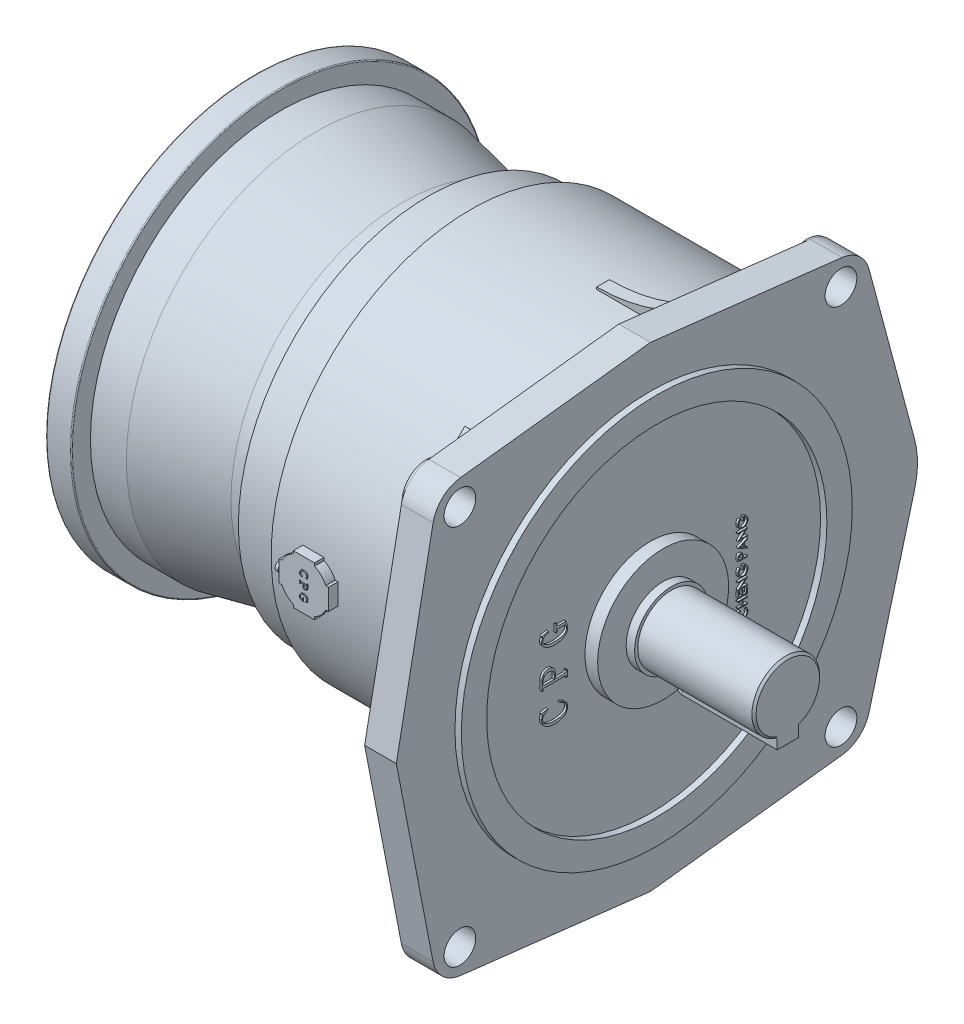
SolidWorks part; units mm, degrees
ref_plane "前视基准面" through (0, 0, 0) normal (0, 0, 1) x (1, 0, 0)
ref_plane "上视基准面" through (0, 0, 0) normal (0, 1, 0) x (1, 0, 0)
ref_plane "右视基准面" through (0, 0, 0) normal (1, 0, 0) x (0, 0, -1)
sketch "草图1" plane through (0, 0, 0) normal (0, 1, 0) x (1, 0, 0)
  line L0 (0, 0) -> (15.7361, 0) construction
  line L1 (0, 0) -> (0, -16)
  line L2 (0, -16) -> (-55, -16)
  line L3 (-55, -16) -> (-55, -17.5)
  line L4 (-55, -17.5) -> (-59, -17.5)
  line L5 (-62, -31) -> (-62, -92.5)
  line L6 (-62, -92.5) -> (-65, -92.5)
  line L7 (-65, -92.5) -> (-65, 0)
  line L8 (-65, 0) -> (0, 0)
  line L9 (-62, -31) -> (-59, -31)
  line L10 (-59, -31) -> (-59, -17.5)
  dimension "D1" = 55
  dimension "D2" = 32
  dimension "D3" = 35
  dimension "D4" = 3
  dimension "D5" = 185
  dimension "D6" = 65
  dimension "D7" = 3
  dimension "D8" = 62
revolve "旋转1" add sketch "草图1" angle 360 about L0
sketch "草图2" plane through (0, 0, 0) normal (0, 1, 0) x (1, 0, 0)
  line L0 (8.0167, 30) -> (-80, 30) construction
  line L1 (-65, 92.5) -> (-65, -92.5) construction
  line L4 (-80, 30) -> (-80, -64.5)
  line L5 (-80, -64.5) -> (-180, -64.5)
  line L6 (-180, -64.5) -> (-180, 30)
  line L11 (-80, 30) -> (-180, 30)
  dimension "D1" = 30
  dimension "D2" = 15
  dimension "D3" = 189
  dimension "D5" = 100
revolve "旋转2" add sketch "草图2" angle 360 about L0
sketch "草图12" plane through (-80, 0, 0) normal (1, 0, 0) x (0, 0, -1)
  line L0 (0, -112.5) -> (100.7627, -100.7627)
  line L1 (-100.7627, -100.7627) -> (0, -112.5)
  line L2 (-100.7627, -100.7627) -> (-120.238, 0)
  line L3 (-100.7627, 100.7627) -> (0, 112.5)
  line L4 (100.7627, -100.7627) -> (127.762, 0)
  line L5 (-120.238, 0) -> (-100.7627, 100.7627)
  line L6 (0, 112.5) -> (100.7627, 100.7627)
  line L7 (127.762, 0) -> (100.7627, 100.7627)
  line L8 (167.8979, 0) -> (-107.2143, 0) construction
  line L9 (0, 107.5085) -> (0, -103.3164) construction
  line L10 (0, 0) -> (-90.1561, 90.1561) construction
  line L11 (0, 0) -> (90.1561, 90.1561) construction
  circle A0 centre (0, 0) radius 127.5 construction
  circle A1 centre (-90.1561, 90.1561) radius 7.5
  circle A2 centre (90.1561, 90.1561) radius 7.5
  circle A3 centre (90.1561, -90.1561) radius 7.5
  circle A4 centre (-90.1561, -90.1561) radius 7.5
  dimension "D3" = 255
  dimension "D4" = 15
  dimension "D5" = 15
  dimension "D1" = 225
  dimension "D2" = 248
  dimension "D6" = 15
extrude "拉伸8" add sketch "草图12" along normal up to surface (15 mm away)
sketch "草图5" plane through (0, 0, 0) normal (0, 1, 0) x (1, 0, 0)
  line L0 (0, -5) -> (-45, -5)
  line L1 (0, -16) -> (0, 16) construction
  line L2 (-45, 5) -> (0, 5)
  line L3 (0, 5) -> (0, -5)
  line L4 (35.5, -13.7955) -> (35.5, 19.6443) construction
  arc A0 (-45, -5) -> (-45, 5) centre (-45, 0) cw
  dimension "D2" = 50
  dimension "D1" = 10
  dimension "D3" = 35.5
extrude "拉伸4" add sketch "草图5" against normal blind 19.5
fillet "圆角4" radius 15 4 edges at (-72.5, 100.7627, 100.7627) (-72.5, 100.7627, -100.7627) (-72.5, -100.7627, -100.7627) (-72.5, -100.7627, 100.7627)
fillet "圆角5" radius 40 1 edges at (-72.5, 0, -127.762)
chamfer "倒角1" distance 1 angle 45 1 edges at (0, 16, 0)
sketch "草图18" plane through (-80, 0, 0) normal (-1, 0, 0) x (0, 0, 1)
  line L0 (-30, 0) -> (73.8927, -103.8927) construction
  line L1 (0, -99) -> (0, 99) construction
  line L2 (89.8548, -102.0333) -> (0, -112.5) construction
  line L3 (36.8216, -66.8216) -> (73.8927, -103.8927)
  line L4 (-30, 0) -> (-90.1561, -90.1561) construction
  line L5 (-88.91, -87.0419) -> (-82.4506, -78.6078)
  line L7 (-30, 0) -> (-30, -109.0055) construction
  line L8 (0, -112.5) -> (-90.6456, -101.9412) construction
  line L9 (-30, -98.3819) -> (-30, -109.0055)
  circle A0 centre (-30, 0) radius 94.5 construction
  arc A1 (-103.3989, -90.9242) -> (-90.6456, -101.9412) centre (-88.91, -87.0419) ccw construction
  dimension "D1" = 45
  dimension "D2" = 10.6235
  dimension "D4" = 52.4264
  dimension "D5" = 10.6235
ref_plane "基准面7" through (-81, 0, 0) normal (1, 0, 0) x (0, 0, -1)
sketch "草图13" plane through (-80, 0, 0) normal (1, 0, 0) x (0, 0, -1)
  line L5 (0, 0) -> (107.7406, 0) construction
  circle A1 centre (90.1561, 90.1561) radius 11.6458
  circle A3 centre (90.1561, 90.1561) radius 7.5
  circle A4 centre (90.1561, -90.1561) radius 7.5 construction
  circle A5 centre (90.1561, -90.1561) radius 7.5
  circle A7 centre (-90.1561, -90.1561) radius 7.5
  arc A10 (90.6456, -101.9412) -> (103.3989, -90.9242) centre (88.91, -87.0419) ccw construction
  circle A11 centre (-90.1561, -90.1561) radius 7.5 construction
  arc A12 (-102.8467, -89.9806) -> (-89.8548, -102.0333) centre (-88.1192, -87.1341) ccw construction
  circle A14 centre (-90.1561, 90.1561) radius 7.5
  circle A15 centre (-90.1561, 90.1561) radius 11.3556
  circle A20 centre (-90.1561, -90.1561) radius 11.3556
  circle A21 centre (90.1561, -90.1561) radius 11.6458
  point P8 (30, 0)
extrude "拉伸9" add sketch "草图13" against normal up to surface (1 mm away)
sketch "草图14" plane through (0, 0, 0) normal (0, 1, 0) x (1, 0, 0)
  line L0 (-80, 30) -> (-180, 30) construction
  line L5 (-80, -89.8548) -> (-80, 0) construction
  line L6 (-117.4264, -64.5) -> (-117.4264, -65.5)
  line L7 (-80, -101.9264) -> (-81, -101.9264)
  line L9 (-80, -64.5) -> (-180, -64.5) construction
  arc A0 (-81, -101.9264) -> (-117.4264, -65.5) centre (-117.4264, -101.9264) ccw
  dimension "D1" = 131.9264
  dimension "D2" = 1
  dimension "D3" = 1
rib "筋17" sketch "草图14" sketch "草图14" thickness 6 extrusion direction parallel to sketch draft on no parameters "D1"=6
pattern_circular "阵列(圆周)16" count 8 over 360 about axis through (0, 0, -30) along (1, 0, 0) of "筋17"
ref_plane "基准面8" through (0, 0, -30) normal (0, 0, 1) x (1, 0, 0)
sketch "草图17" plane through (0, 0, -30) normal (0, 0, 1) x (1, 0, 0)
  line L0 (-80, -104.1235) -> (-81, -104.1235)
  line L1 (-80, -102.0333) -> (-80, -112.5) construction
  line L2 (-117.4264, -94.5) -> (-117.4264, -95.5)
  line L4 (-180, -94.5) -> (-80, -94.5) construction
  line L6 (-117.4264, -69.65) -> (-117.4264, -65.4074) construction
  arc A0 (-81, -104.1235) -> (-117.4264, -95.5) centre (-117.4264, -176.7456) ccw
  dimension "D1" = 9.6235
  dimension "D2" = 1
  dimension "D3" = 1
rib "筋24" sketch "草图17" sketch "草图17" thickness 6 extrusion direction parallel to sketch draft on no parameters "D1"=6
mirror "镜向1" about plane through (0, 0, 0) normal (0, 1, 0) of "筋24"
sketch "草圖1" plane through (0, 0, 0) normal (0, 1, 0) x (1, 0, 0)
  line L0 (-268.4998, 30) -> (-180, 30)
  line L1 (-281.4998, 129) -> (-270.4998, 129)
  line L2 (-269.9998, 128.5) -> (-269.9998, 120.0026)
  line L3 (-269.9475, 120) -> (-252.9998, 120)
  line L4 (-252.9998, 120) -> (-212, 111.5)
  line L5 (-240.9998, 77.375) -> (-240.9998, 78.1207)
  line L6 (-281.9998, 128.5) -> (-281.9998, 95)
  line L7 (-267.9998, 71) -> (-242.9998, 71)
  line L8 (-269.9998, 69) -> (-269.9998, 56)
  line L9 (-307.0981, 30) -> (-200, 30) construction
  line L10 (-281.9998, 95) -> (-277.6998, 95)
  line L11 (-242.3496, 83.0029) -> (-277.6998, 95)
  line L12 (-268.4998, 56) -> (-268.4998, 30)
  line L13 (-239.6838, 80.0001) -> (-239.6838, 80.0215)
  line L14 (-269.9998, 56) -> (-268.4998, 56)
  line L16 (-212, 111.5) -> (-200, 111.5)
  line L17 (-200, 111.5) -> (-200, 120)
  line L19 (-180, 124.5) -> (-180, -64.5) construction
  line L20 (-180, 120) -> (-180, 30)
  line L21 (-200, 120) -> (-180, 120)
  arc A0 (-239.6838, 80.0001) -> (-240.9998, 78.1207) centre (-238.9998, 78.1207) ccw
  arc A1 (-242.9998, 71) -> (-240.9998, 77.375) centre (-250.8093, 76.9513) ccw
  arc A2 (-267.9998, 71) -> (-269.9998, 69) centre (-267.9998, 69) ccw
  arc A6 (-239.6838, 80.0215) -> (-242.3496, 83.0029) centre (-242.6838, 80.0215) ccw
  arc A7 (-269.9998, 120.0026) -> (-269.9475, 120) centre (-269.9475, 120.5232) ccw
  arc A8 (-281.4998, 129) -> (-281.9998, 128.5) centre (-281.4998, 128.5) ccw
  arc A9 (-269.9998, 128.5) -> (-270.4998, 129) centre (-270.4998, 128.5) ccw
  dimension "D1" = 198
  dimension "D2" = 130
  dimension "D3" = 180
  dimension "D4" = 81.9998
  dimension "D5" = 200
  dimension "D6" = 281.9998
  dimension "D12" = 180
  dimension "D13" = 163
  dimension "D14" = 30
revolve "旋轉1" add sketch "草圖1" angle 360 about L9
sketch "草圖2" plane through (-281.9998, 0, 0) normal (-1, 0, 0) x (0, 0, 1)
  circle A0 centre (-30, 0) radius 82.5 construction
  circle A1 centre (-88.3363, 58.3363) radius 5
  circle A2 centre (28.3363, 58.3363) radius 5
  circle A3 centre (28.3363, -58.3363) radius 5
  circle A4 centre (-88.3363, -58.3363) radius 5
  dimension "D1" = 165
  dimension "D2" = 10
extrude "伸長1" cut sketch "草圖2" against normal blind 25
sketch "草圖3" plane through (-281.9998, 0, 0) normal (-1, 0, 0) x (0, 0, 1)
  line L0 (22.4023, 23.0903) -> (40.6304, 31.1223)
  line L1 (-53.0903, -52.4023) -> (-61.1223, -70.6304)
  line L2 (19.5204, 27.4054) -> (28.2893, 34.6515)
  line L3 (29.1698, 46.1366) -> (23.033, 53.033)
  line L4 (-30, 0) -> (-30, 84.5) construction
  line L5 (19.5204, -27.4054) -> (28.2893, -34.6515)
  line L6 (-6.9097, -52.4023) -> (1.1223, -70.6304)
  line L7 (-82.4023, 23.0903) -> (-100.6304, 31.1223)
  line L8 (-79.5204, -27.4054) -> (-88.2893, -34.6515)
  line L9 (-2.5946, 49.5204) -> (4.6515, 58.2893)
  line L10 (-2.5946, -49.5204) -> (4.6515, -58.2893)
  line L11 (-30, 0) -> (-114.5, 0) construction
  line L12 (16.1366, -59.1698) -> (23.033, -53.033)
  line L13 (-57.4054, 49.5204) -> (-64.6515, 58.2893)
  line L14 (22.4023, -23.0903) -> (40.6304, -31.1223)
  line L15 (29.1698, -46.1366) -> (23.033, -53.033)
  line L16 (-53.0903, 52.4023) -> (-61.1223, 70.6304)
  line L17 (16.1366, 59.1698) -> (23.033, 53.033)
  line L18 (-30, 0) -> (54.5, 0) construction
  line L19 (-30, 0) -> (-30, -84.5) construction
  line L20 (-79.5204, 27.4054) -> (-88.2893, 34.6515)
  line L21 (-57.4054, -49.5204) -> (-64.6515, -58.2893)
  line L22 (-82.4023, -23.0903) -> (-100.6304, -31.1223)
  line L23 (-76.1366, 59.1698) -> (-83.033, 53.033)
  line L24 (-89.1698, -46.1366) -> (-83.033, -53.033)
  line L25 (-76.1366, -59.1698) -> (-83.033, -53.033)
  line L26 (-89.1698, 46.1366) -> (-83.033, 53.033)
  line L27 (-6.9097, 52.4023) -> (1.1223, 70.6304)
  arc A0 (-79.0121, -24.9562) -> (-79.5204, -27.4054) centre (-80.7944, -25.8637) cw
  arc A1 (-79.0121, 24.9562) -> (-79.5204, 27.4054) centre (-80.7944, 25.8637) ccw
  arc A2 (29.1698, -46.1366) -> (28.2893, -34.6515) centre (23.1934, -40.8184) ccw
  arc A3 (50.0874, -26.949) -> (54.5, 0) centre (-30, 0) ccw
  arc A4 (-53.0903, 52.4023) -> (-53.9103, 49.5308) centre (-54.7798, 51.3319) cw
  arc A5 (-3.051, -80.0874) -> (1.1223, -70.6304) centre (-5.2834, -73.453) ccw
  arc A6 (16.1366, 59.1698) -> (4.6515, 58.2893) centre (10.8184, 53.1934) ccw
  arc A7 (-56.949, -80.0874) -> (-30, -84.5) centre (-30, 0) ccw
  arc A8 (-3.051, 80.0874) -> (-30, 84.5) centre (-30, 0) ccw
  arc A9 (-56.949, 80.0874) -> (-61.1223, 70.6304) centre (-54.7166, 73.453) ccw
  arc A10 (19.0121, -24.9562) -> (19.5204, -27.4054) centre (20.7944, -25.8637) ccw
  arc A11 (-76.1366, 59.1698) -> (-64.6515, 58.2893) centre (-70.8184, 53.1934) cw
  arc A12 (16.1366, -59.1698) -> (4.6515, -58.2893) centre (10.8184, -53.1934) cw
  arc A13 (-82.4023, 23.0903) -> (-79.5308, 23.9103) centre (-81.3319, 24.7798) ccw
  arc A14 (-82.4023, -23.0903) -> (-79.5308, -23.9103) centre (-81.3319, -24.7798) cw
  arc A15 (-54.9562, 49.0121) -> (-57.4054, 49.5204) centre (-55.8637, 50.7944) cw
  arc A16 (-54.9562, -49.0121) -> (-57.4054, -49.5204) centre (-55.8637, -50.7944) ccw
  arc A17 (-5.0438, 49.0121) -> (-6.0897, 49.5308) centre (-30, 0) ccw
  arc A18 (50.0874, 26.949) -> (54.5, 0) centre (-30, 0) cw
  arc A19 (-110.0874, -26.949) -> (-114.5, 0) centre (-30, 0) cw
  arc A20 (-110.0874, 26.949) -> (-100.6304, 31.1223) centre (-103.453, 24.7166) cw
  arc A21 (29.1698, 46.1366) -> (28.2893, 34.6515) centre (23.1934, 40.8184) cw
  arc A22 (19.0121, 24.9562) -> (19.5204, 27.4054) centre (20.7944, 25.8637) cw
  arc A23 (-54.9562, -49.0121) -> (-53.9103, -49.5308) centre (-30, 0) ccw
  arc A24 (-6.9097, 52.4023) -> (-6.0897, 49.5308) centre (-5.2202, 51.3319) ccw
  arc A25 (-110.0874, -26.949) -> (-100.6304, -31.1223) centre (-103.453, -24.7166) ccw
  arc A26 (-54.9562, 49.0121) -> (-53.9103, 49.5308) centre (-30, 0) cw
  arc A27 (-76.1366, -59.1698) -> (-64.6515, -58.2893) centre (-70.8184, -53.1934) ccw
  arc A28 (-79.0121, 24.9562) -> (-79.5308, 23.9103) centre (-30, 0) ccw
  arc A29 (50.0874, 26.949) -> (40.6304, 31.1223) centre (43.453, 24.7166) ccw
  arc A30 (19.0121, 24.9562) -> (19.5308, 23.9103) centre (-30, 0) cw
  arc A31 (-89.1698, -46.1366) -> (-88.2893, -34.6515) centre (-83.1934, -40.8184) cw
  arc A32 (22.4023, 23.0903) -> (19.5308, 23.9103) centre (21.3319, 24.7798) cw
  arc A33 (-53.0903, -52.4023) -> (-53.9103, -49.5308) centre (-54.7798, -51.3319) ccw
  arc A34 (-5.0438, 49.0121) -> (-2.5946, 49.5204) centre (-4.1363, 50.7944) ccw
  arc A35 (22.4023, -23.0903) -> (19.5308, -23.9103) centre (21.3319, -24.7798) ccw
  arc A36 (-5.0438, -49.0121) -> (-2.5946, -49.5204) centre (-4.1363, -50.7944) cw
  arc A37 (50.0874, -26.949) -> (40.6304, -31.1223) centre (43.453, -24.7166) cw
  arc A38 (-79.0121, -24.9562) -> (-79.5308, -23.9103) centre (-30, 0) cw
  arc A39 (-5.0438, -49.0121) -> (-6.0897, -49.5308) centre (-30, 0) cw
  circle A40 centre (-30, 0) radius 50
  arc A41 (-56.949, -80.0874) -> (-61.1223, -70.6304) centre (-54.7166, -73.453) cw
  arc A42 (-6.9097, -52.4023) -> (-6.0897, -49.5308) centre (-5.2202, -51.3319) cw
  arc A43 (19.0121, -24.9562) -> (19.5308, -23.9103) centre (-30, 0) ccw
  arc A44 (-110.0874, 26.949) -> (-114.5, 0) centre (-30, 0) ccw
  arc A45 (-3.051, -80.0874) -> (-30, -84.5) centre (-30, 0) cw
  arc A46 (-3.051, 80.0874) -> (1.1223, 70.6304) centre (-5.2834, 73.453) cw
  arc A47 (-89.1698, 46.1366) -> (-88.2893, 34.6515) centre (-83.1934, 40.8184) ccw
  arc A49 (-56.949, 80.0874) -> (-30, 84.5) centre (-30, 0) cw
  point P30 (-69.9374, 64.6861)
  point P62 (34.6861, 39.9374)
  point P91 (9.9374, -64.6861)
  point P120 (-94.6861, -39.9374)
  dimension "D1" = 110
extrude "伸長2" cut sketch "草圖3" against normal blind 48.5
sketch "草圖4" plane through (-233.4998, 0, 0) normal (-1, 0, 0) x (0, 0, 1)
  circle A0 centre (-30, 0) radius 66.5 construction
  circle A1 centre (-77.0226, 47.0226) radius 3.5
  circle A2 centre (17.0226, 47.0226) radius 3.5
  circle A3 centre (17.0226, -47.0226) radius 3.5
  circle A4 centre (-77.0226, -47.0226) radius 3.5
  dimension "D1" = 133
extrude "伸長3" cut sketch "草圖4" against normal blind 11
sketch "草圖5" plane through (-268.4998, 0, 0) normal (-1, 0, 0) x (0, 0, 1)
  line L0 (-7.5, 0) -> (-52.5, 0) construction
  line L1 (-30, -22.5) -> (-30, 22.5) construction
  line L2 (-18.6863, -4) -> (-14.7, -4)
  line L3 (-18.6863, 4) -> (-14.7, 4)
  line L4 (-14.7, 4) -> (-14.7, -4)
  arc A0 (-18.6863, 4) -> (-18.6863, -4) centre (-30, 0) ccw
  circle A1 centre (-30, 0) radius 19.75 construction
  dimension "D1" = 12
  dimension "D2" = 8
  dimension "D3" = 15.3
extrude "伸長4" cut sketch "草圖5" against normal blind 46
sketch "草圖6" plane through (-268.4998, 0, 0) normal (-1, 0, 0) x (0, 0, 1)
  line L0 (-18.6863, 4) -> (-14.7, 4) construction
  line L1 (-14.7, 4) -> (-14.7, -4) construction
  line L2 (-18.6863, -4) -> (-14.7, -4) construction
  line L3 (-18.6863, 4) -> (-14.7, 4)
  line L4 (-14.7, 4) -> (-14.7, -4)
  line L5 (-18.6863, -4) -> (-14.7, -4)
  arc A0 (-18.6863, 4) -> (-18.6863, -4) centre (-30, 0) ccw construction
  circle A1 centre (-30, 0) radius 19.75 construction
  arc A2 (-18.6863, 4) -> (-18.6863, -4) centre (-30, 0) ccw
  circle A3 centre (-30, 0) radius 19.75
extrude "伸長5" add sketch "草圖6" along normal blind 1
sketch "草圖7" plane through (-62, 0, 0) normal (1, 0, 0) x (0, 0, -1)
  circle A0 centre (0, 0) radius 80.5
  circle A1 centre (0, 0) radius 31 construction
  circle A2 centre (0, 0) radius 31
  dimension "D1" = 161
extrude "伸長6" cut sketch "草圖7" against normal blind 3
sketch "草圖8"
  dimension "D1" = 40
  dimension "D2" = 45
  dimension "D3" = 70
  dimension "D4" = 70
  dimension "D5" = 35
extrude "伸長7" add sketch "草圖8" along normal blind 1
ref_plane "平面1" through (0, 0, 69) normal (0, 0, 1) x (1, 0, 0)
sketch "草圖9" plane through (0, 0, 69) normal (0, 0, 1) x (1, 0, 0)
  line L0 (-165, 11.65) -> (-155, 11.65)
  line L1 (-165, 11.65) -> (-165, 10.5119)
  line L2 (-155, 11.65) -> (-155, 10.5119)
  line L3 (-165, -10.5119) -> (-165, -11.65)
  line L4 (-155, -10.5119) -> (-155, -11.65)
  line L5 (-171.65, 5) -> (-170.5119, 5)
  line L6 (-171.65, -5) -> (-170.5119, -5)
  line L7 (-171.65, -5) -> (-171.65, 5)
  line L8 (-165, -11.65) -> (-165, -10.5119)
  line L9 (-155, -11.65) -> (-155, -10.5119)
  line L10 (-155, -11.65) -> (-165, -11.65)
  line L11 (-148.35, -5) -> (-149.4881, -5)
  line L12 (-148.35, 5) -> (-149.4881, 5)
  line L13 (-148.35, 5) -> (-148.35, -5)
  arc A0 (-165.1383, 10.2882) -> (-170.2882, 5.1383) centre (-160, 0) ccw
  arc A1 (-165.1383, 10.2882) -> (-165, 10.5119) centre (-165.25, 10.5119) ccw
  arc A2 (-155, 10.5119) -> (-154.8617, 10.2882) centre (-154.75, 10.5119) ccw
  arc A3 (-170.5119, 5) -> (-170.2882, 5.1383) centre (-170.5119, 5.25) ccw
  arc A4 (-170.2882, -5.1383) -> (-170.5119, -5) centre (-170.5119, -5.25) ccw
  arc A5 (-165, -10.5119) -> (-165.1383, -10.2882) centre (-165.25, -10.5119) ccw
  arc A6 (-154.8617, -10.2882) -> (-155, -10.5119) centre (-154.75, -10.5119) ccw
  arc A7 (-149.4881, -5) -> (-149.7118, -5.1383) centre (-149.4881, -5.25) ccw
  arc A8 (-149.7118, 5.1383) -> (-149.4881, 5) centre (-149.4881, 5.25) ccw
  arc A9 (-149.7118, 5.1383) -> (-154.8617, 10.2882) centre (-160, 0) ccw
  arc A10 (-170.2882, -5.1383) -> (-165.1383, -10.2882) centre (-160, 0) ccw
  arc A11 (-154.8617, -10.2882) -> (-149.7118, -5.1383) centre (-160, 0) ccw
extrude "伸長8" add sketch "草圖9" against normal blind 4.5 contours A6 A11 A7 L11 L13 L12 A8 A9 A2 L2 L0 L1 A1 A0 A3 L5 L7 L6 A4 A10 A5 L3 L10 L4
sketch "草圖10"
extrude "伸長9" add sketch "草圖10" along normal blind 0.5
sketch "草圖11" plane through (0, 0, 0) normal (0, 1, 0) x (1, 0, 0)
  line L0 (-173.8855, -66.75) -> (-165.8855, -66.75)
  line L1 (-173.8855, -66.75) -> (-173.8855, -64.75)
  line L2 (-172.3855, -65.5) -> (-172.3855, -64.75)
  line L4 (-170.2882, -69) -> (-165.1383, -69) construction
  line L13 (-170.3855, -65.5) -> (-165.8855, -65.75)
  line L15 (-172.3855, -65.5) -> (-170.3855, -65.5)
  line L23 (-173.8855, -64.75) -> (-172.3855, -64.75)
  line L24 (-170.3855, -66.75) -> (-170.3855, -65.5)
  line L25 (-165.8855, -66.75) -> (-165.8855, -65.75)
  dimension "D1" = 2.25
revolve "旋轉2" add sketch "草圖11" angle 360 about L0
equation "\"D1@拉伸4\" = \"D3@草图5\"-\"D2@草图1\"/2"
equation "\"D3@草图1\"=\"D2@草图1\"+3"
equation "\"D5@草图1\" = \"D1@草圖7\"+24"
equation "\"D4@草圖1\" = \"D6@草圖1\"-\"D5@草圖1\""
